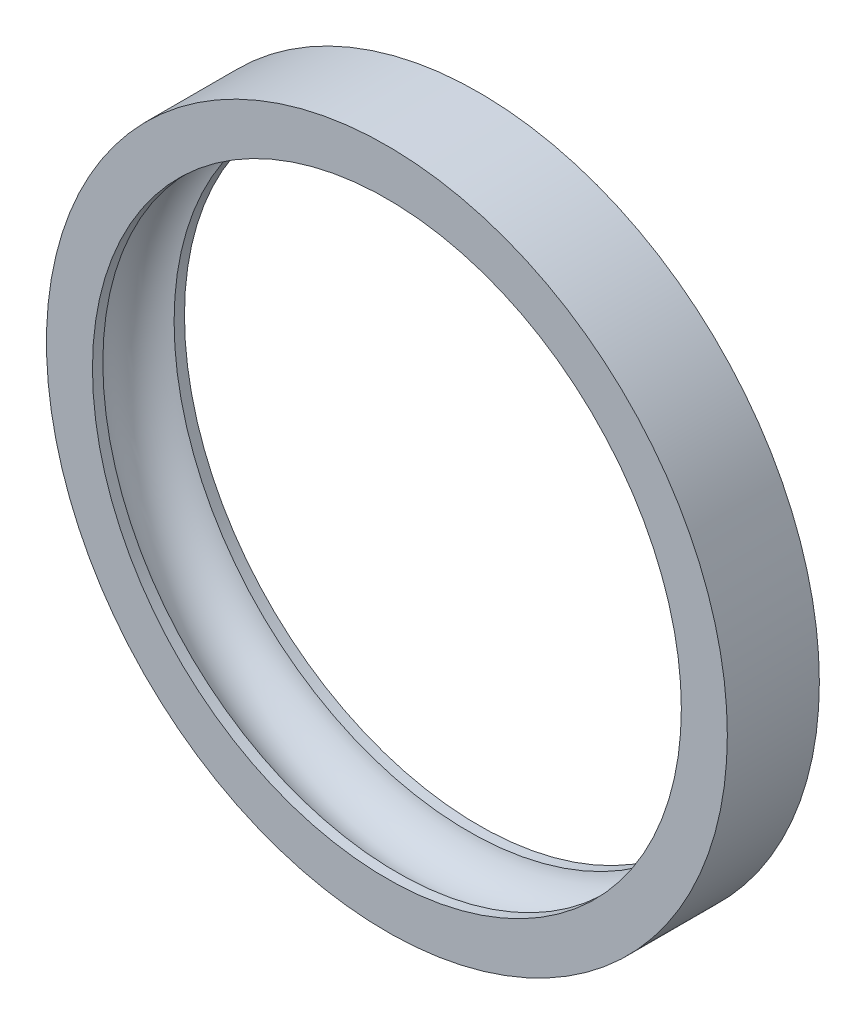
SolidWorks part; units mm, degrees
ref_plane "Спереди" through (0, 0, 0) normal (0, 0, 1) x (1, 0, 0)
ref_plane "Сверху" through (0, 0, 0) normal (0, 1, 0) x (1, 0, 0)
ref_plane "Справа" through (0, 0, 0) normal (1, 0, 0) x (0, 0, -1)
sketch "Эскиз1" plane through (0, 0, 0) normal (0, 0, 1) x (1, 0, 0)
  circle A1 centre (0, 0) radius 37
sketch "Эскиз2" plane through (0, 0, 0) normal (0, 0, 1) x (1, 0, 0)
  circle A0 centre (0, 0) radius 32
extrude "Бобышка-Вытянуть5" add sketch "Эскиз1" along normal blind 10
extrude "Вырез-Вытянуть9" cut sketch "Эскиз2" along normal blind 10 contours A0
sketch "Эскиз8" plane through (0, 0, 0) normal (1, 0, 0) x (0, 0, -1)
  line L0 (0, 0) -> (-14.9467, 0) construction
  line L2 (-1.127, 32) -> (-8.873, 32)
  arc A0 (-1.127, 32) -> (-8.873, 32) centre (-5, 31) ccw
revolve "Вырез-Повернуть4" cut sketch "Эскиз8" angle 360 about L0
